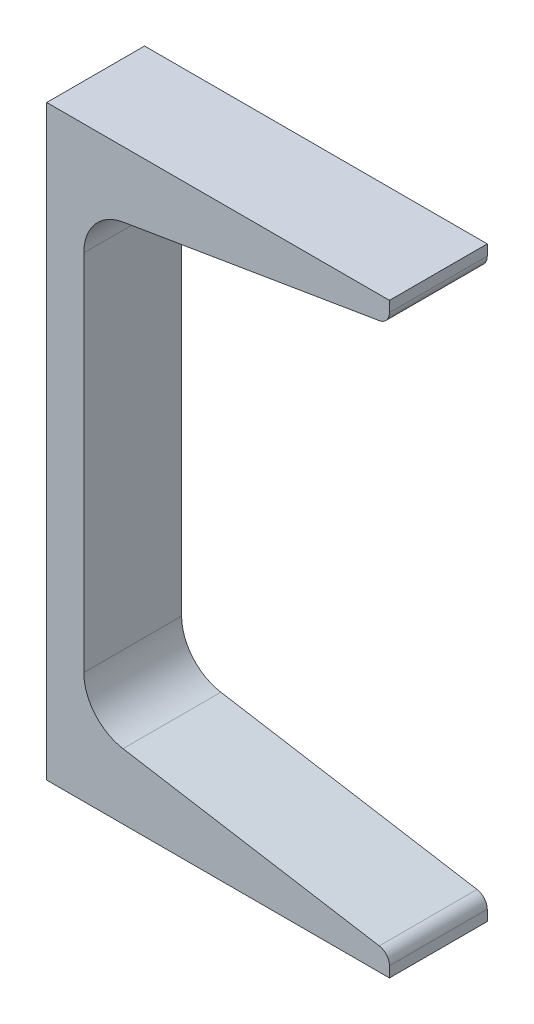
SolidWorks part; units mm, degrees
ref_plane "Plane1" through (0, 0, 0) normal (0, 0, 1) x (1, 0, 0)
ref_plane "Plane2" through (0, 0, 0) normal (0, 1, 0) x (-1, 0, 0)
ref_plane "Plane3" through (0, 0, 0) normal (1, 0, 0) x (0, 0, -1)
sketch "Sketch1" plane through (0, 0, 0) normal (0, 0, 1) x (1, 0, 0)
  line L0 (89.0016, 152.4) -> (0, 152.4)
  line L1 (89.0016, 0) -> (0, 0)
  line L2 (0, 152.4) -> (0, 0)
  line L3 (7.8492, 0) -> (-7.8492, 0) construction
  line L4 (0, -15.6984) -> (0, 15.6984) construction
  line L5 (0, 12.065) -> (89.0016, 12.065) construction
  line L6 (89.0016, 152.4) -> (89.0016, 146.9501)
  line L7 (89.0016, 0) -> (89.0016, 5.4499)
  line L12 (9.6266, 123.3919) -> (9.6266, 29.0081)
  line L17 (19.8141, 135.418) -> (89.0016, 146.9501)
  line L18 (19.8141, 16.982) -> (89.0016, 5.4499)
  arc A9 (9.6266, 29.0081) -> (19.8141, 16.982) centre (21.8186, 29.0081) ccw
  arc A10 (9.6266, 123.3919) -> (19.8141, 135.418) centre (21.8186, 123.3919) cw
  dimension "RI" = 12.192
  dimension "D2" = 9.463
  dimension "D3" = 29.0081
  dimension "Depth" = 152.4
  dimension "BF" = 89.0016
  dimension "TW" = 9.6266
  dimension "TF" = 12.065
  dimension "d1" = 94.3838
extrude "BaseMchannel" add sketch "Sketch1" along normal mid plane 25.4
fillet "ToeFillet" radius 3.175 2 edges at (89.0016, 5.4499, 0) (89.0016, 146.9501, 0)
equation "\"d1@Sketch1\" = \"Depth@Sketch1\" - 2*\"TF@Sketch1\" -  2*( \"RI@Sketch1\" * cos(\"D2@Sketch1\"/180*3.141592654))-2*((((\"BF@Sketch1\"-\"TW@Sketch1\")/2)-(\"RI@Sketch1\"-\"RI@Sketch1\"*sin(\"D2@Sketch1\"/180*3.141592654"
equation "\"D3@Sketch1\" =  ( \"Depth@Sketch1\" - \"d1@Sketch1\" )  / 2"
